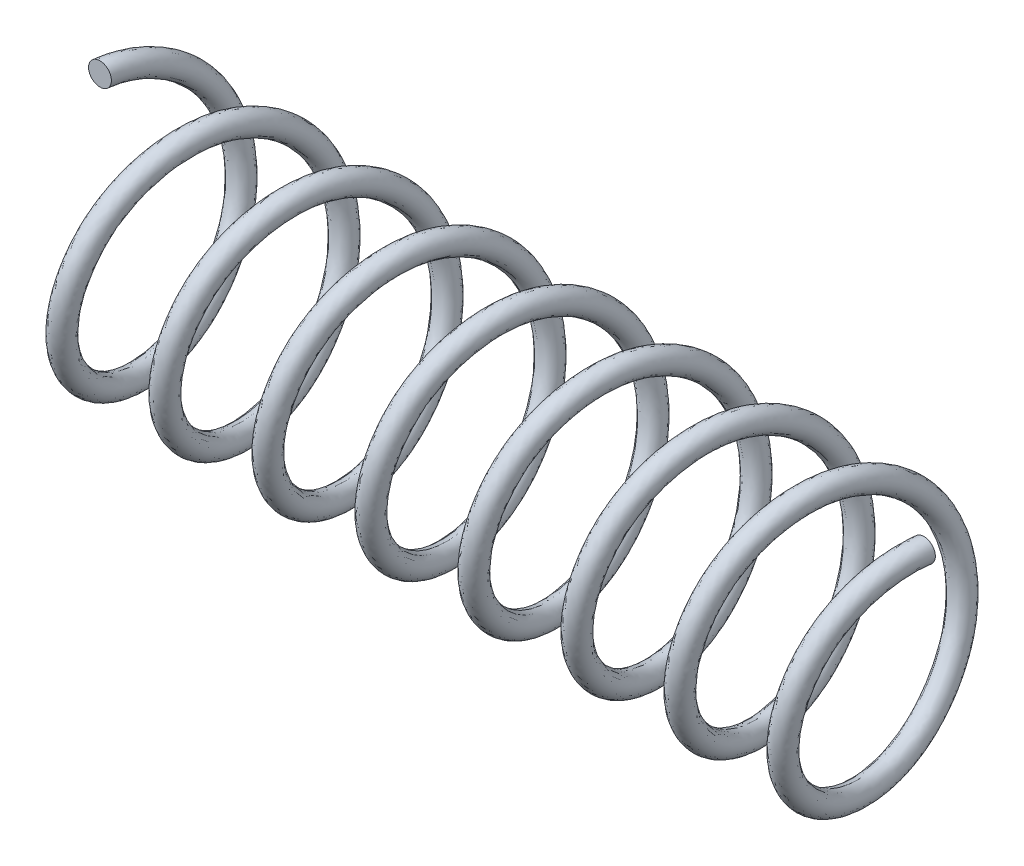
SolidWorks part; units mm, degrees
ref_plane "Ebene vorne" through (0, 0, 0) normal (0, 0, 1) x (1, 0, 0)
ref_plane "Ebene oben" through (0, 0, 0) normal (0, 1, 0) x (1, 0, 0)
ref_plane "Ebene rechts" through (0, 0, 0) normal (1, 0, 0) x (0, 0, -1)
sketch "Skizze1" plane through (0, 0, 0) normal (0, 0, 1) x (1, 0, 0)
  line L0 (-6, 4) -> (-20.45, 4)
  line L2 (-20.45, 2.4) -> (-20.45, 5.6) construction
  line L3 (-6, 6) -> (-6, 2) construction
sketch "Skizze2" plane through (0, 0, 0) normal (0, 0, 1) x (1, 0, 0)
  line L0 (-6, 4) -> (-20.45, 4) construction
  line L1 (-20.45, 1.7) -> (-20.45, 6.3) construction
  circle A0 centre (-20.25, 6) radius 0.2
  dimension "D1" = 0.4
  dimension "D2" = 2
sweep "Austragung1" add profiles "Skizze2" path "Skizze1" parameters "D4"=2880
